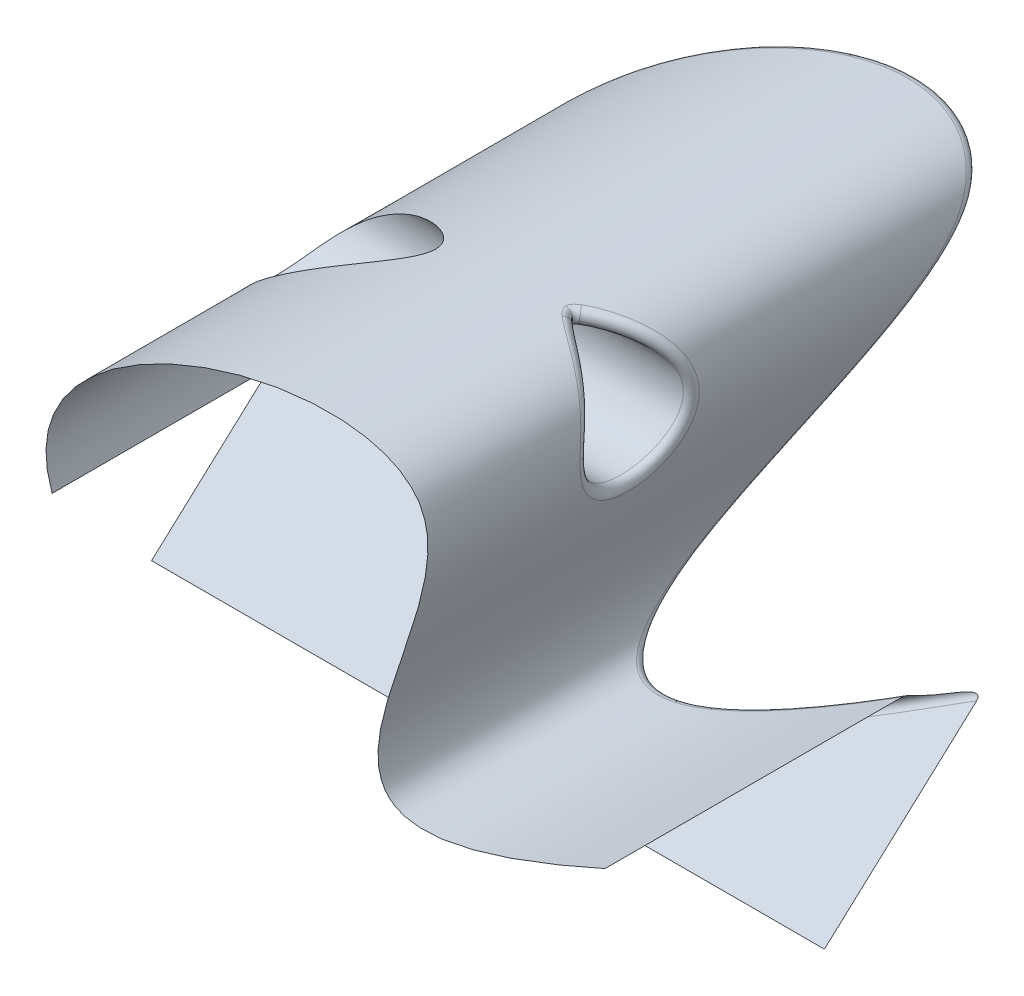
SolidWorks part; units mm, degrees
ref_plane "Front Plane" through (0, 0, 0) normal (0, 0, 1) x (1, 0, 0)
ref_plane "Top Plane" through (0, 0, 0) normal (0, 1, 0) x (1, 0, 0)
ref_plane "Right Plane" through (0, 0, 0) normal (1, 0, 0) x (0, 0, -1)
sketch "Sketch1" plane through (0, 0, 0) normal (0, 0, 1) x (1, 0, 0)
  spline S0 degree 3 poles (-84.2134, -23.6341) (-103.0836, 26.848) (136.3153, 98.7207) (-35.8834, -96.9735) (92.3631, -39.1185) knots 0 0 0 0 0.513155 1 1 1 1
surface "Surface-Extrude1" sketch "Sketch1" parameters "D1"=214.884
sketch "Sketch2" plane through (0, 0, 0) normal (1, 0, 0) x (0, 0, -1)
  line L0 (227.6919, 76.2692) -> (54.9778, -81.3556)
surface "Surface-Extrude2" sketch "Sketch2" parameters "D1"=214.884
sketch "Sketch3" plane through (0, 0, 0) normal (1, 0, 0) x (0, 0, -1)
  circle A0 centre (67.6019, 21.0708) radius 16.4934
surface "Surface-Extrude3" sketch "Sketch3" parameters "D1"=177.292
surface "Surface-Trim4"
surface "Surface-Trim5"
surface "Surface-Trim6"
surface "Surface-Trim7"
surface "Surface-Knit1"
surface "Surface-Knit2"
fillet "Fillet1" radius 2.54 1 edges
fillet "Fillet2" radius 2.54 1 edges
